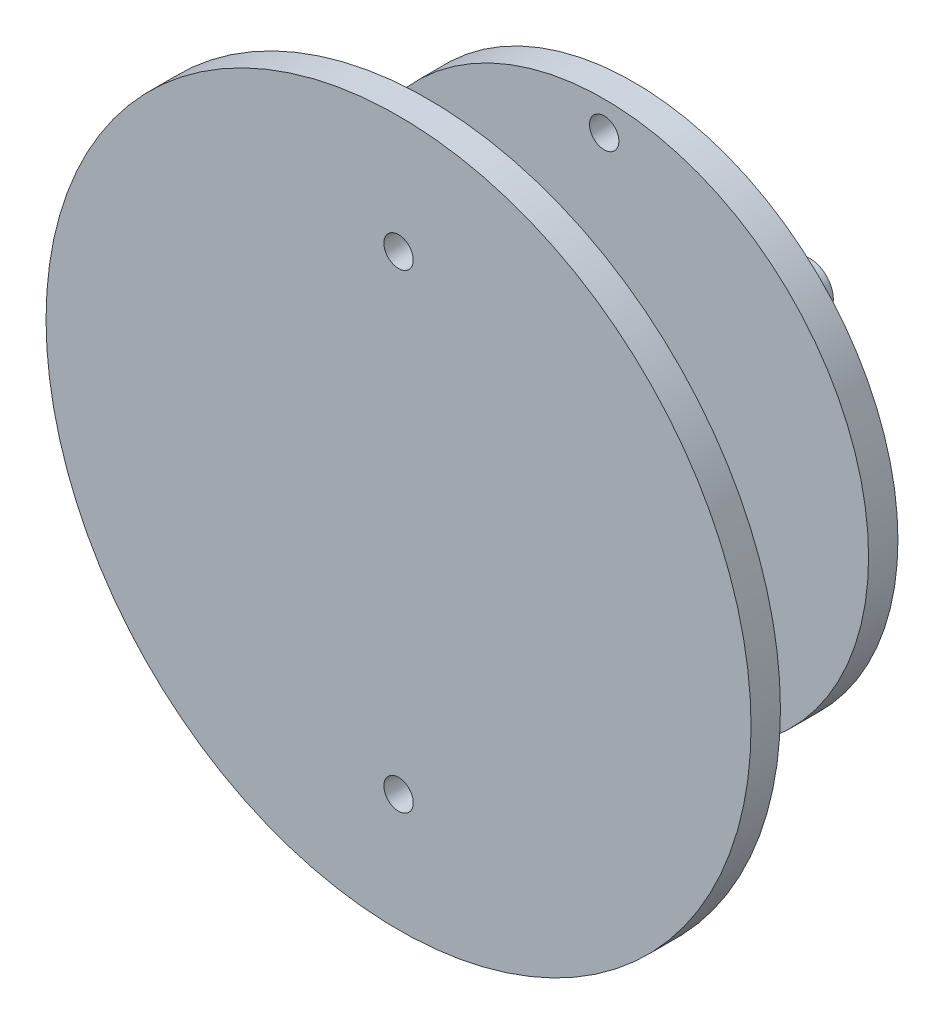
SolidWorks part; units mm, degrees
ref_plane "前视基准面" through (0, 0, 0) normal (0, 0, 1) x (1, 0, 0)
ref_plane "上视基准面" through (0, 0, 0) normal (0, 1, 0) x (1, 0, 0)
ref_plane "右视基准面" through (0, 0, 0) normal (1, 0, 0) x (0, 0, -1)
other "Configuration Table"
sketch "草图1" plane through (0, 0, 0) normal (0, 0, 1) x (1, 0, 0)
  circle A1 centre (0, 0) radius 4
extrude "凸台-拉伸1" add sketch "草图1" along normal blind 70
sketch "草图2" plane through (0, 0, 70) normal (0, 0, 1) x (1, 0, 0)
  circle A0 centre (0, 0) radius 60
  dimension "D1" = 120
extrude "凸台-拉伸2" add sketch "草图2" against normal blind 5
sketch "草图5" plane through (0, 0, 0) normal (0, 0, -1) x (-1, 0, 0)
  circle A0 centre (0, 0) radius 45
  dimension "D1" = 90
extrude "凸台-拉伸3" add sketch "草图5" against normal blind 5 from offset 30
sketch "草图6" plane through (0, 0, 30) normal (0, 0, -1) x (-1, 0, 0)
  circle A0 centre (0, 0) radius 40 construction
  circle A1 centre (0, 40) radius 2.5
  dimension "D1" = 80
  dimension "D2" = 5
extrude "切除-拉伸1" cut sketch "草图6" against normal blind 100
mirror "镜向1" about plane through (0, 0, 0) normal (0, 1, 0) of "切除-拉伸1"
